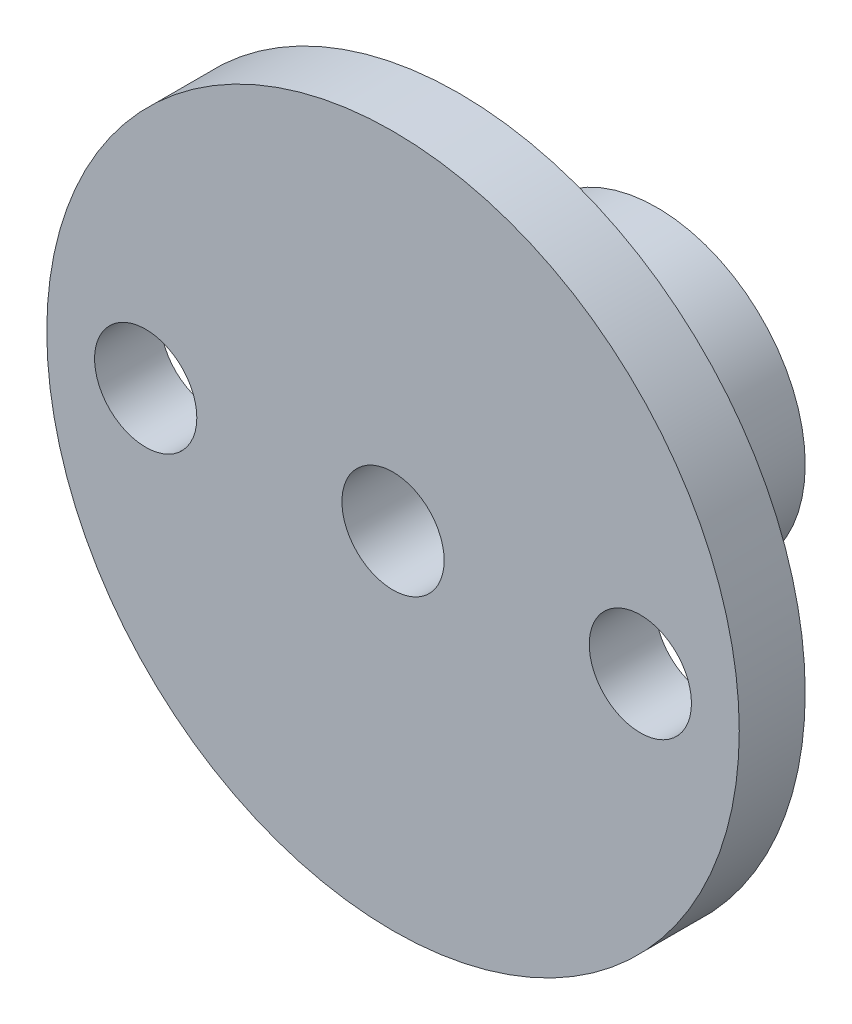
SolidWorks part; units mm, degrees
ref_plane "Plan de face" through (0, 0, 0) normal (0, 0, 1) x (1, 0, 0)
ref_plane "Plan de dessus" through (0, 0, 0) normal (0, 1, 0) x (1, 0, 0)
ref_plane "Plan de droite" through (0, 0, 0) normal (1, 0, 0) x (0, 0, -1)
sketch "Esquisse1" plane through (0, 0, 0) normal (0, 0, 1) x (1, 0, 0)
  circle A0 centre (0, 0) radius 4.5
extrude "Extrusion1" add sketch "Esquisse1" along normal blind 6
sketch "Esquisse2" plane through (0, 0, 6) normal (0, 0, 1) x (1, 0, 0)
  circle A0 centre (0, 0) radius 10.5
extrude "Extrusion2" add sketch "Esquisse2" along normal blind 2
sketch "Esquisse3" plane through (0, 0, 8) normal (0, 0, 1) x (1, 0, 0)
  circle A0 centre (0, 0) radius 1.55
extrude "Enlèv. mat.-Extru.1" cut sketch "Esquisse3" against normal through all
sketch "Esquisse4" plane through (0, 0, 8) normal (0, 0, 1) x (1, 0, 0)
  line L0 (-12.5775, 0) -> (13.3008, 0) construction
  circle A0 centre (0, 0) radius 7.5 construction
  circle A1 centre (-7.5, 0) radius 1.55
  circle A2 centre (7.5, 0) radius 1.55
extrude "Enlèv. mat.-Extru.2" cut sketch "Esquisse4" against normal through all
sketch "Esquisse5" plane through (0, 0, 0) normal (0, 1, 0) x (1, 0, 0)
  line L0 (-11.9961, -3) -> (12.555, -3) construction
  line L1 (0, 2.7795) -> (0, -9.7444) construction
  circle A0 centre (0, -3) radius 1.5
extrude "Enlèv. mat.-Extru.3" cut sketch "Esquisse5" against normal blind 10
